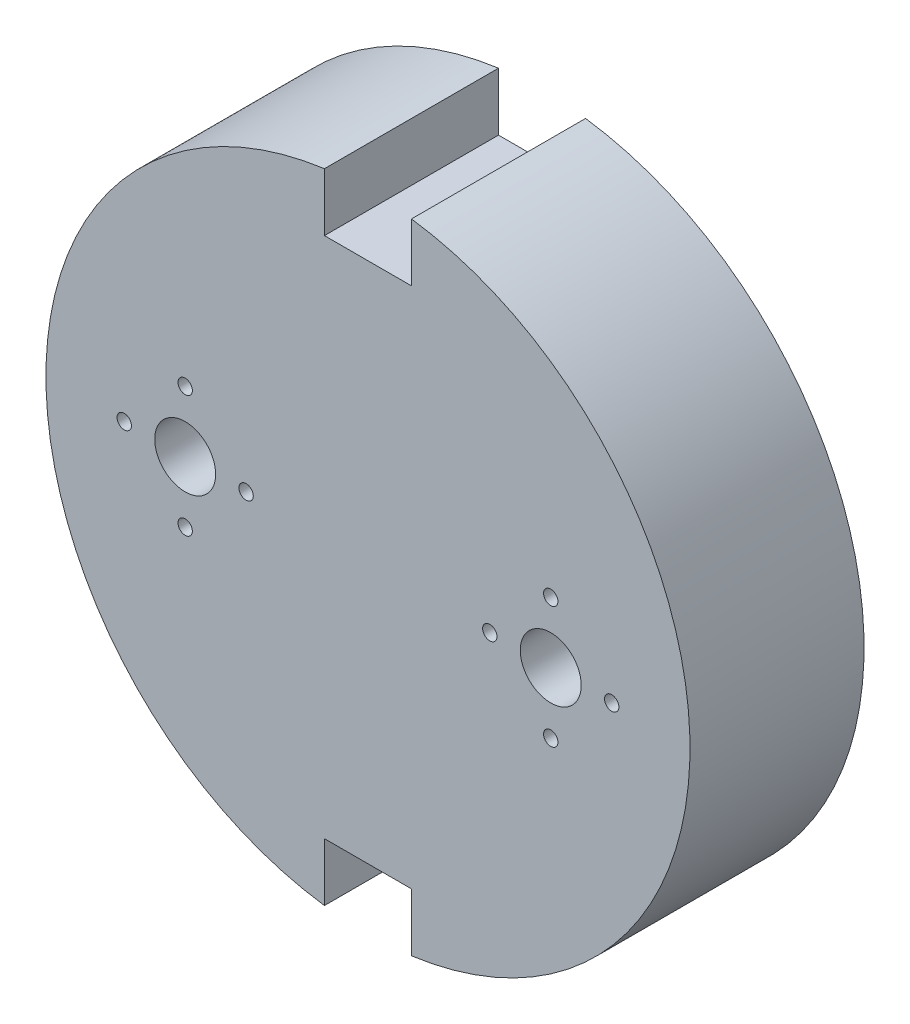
SolidWorks part; units mm, degrees
ref_plane "Plan de face" through (0, 0, 0) normal (0, 0, 1) x (1, 0, 0)
ref_plane "Plan de dessus" through (0, 0, 0) normal (0, 1, 0) x (1, 0, 0)
ref_plane "Plan de droite" through (0, 0, 0) normal (1, 0, 0) x (0, 0, -1)
sketch "Esquisse1" plane through (0, 0, 0) normal (0, 0, 1) x (1, 0, 0)
  line L2 (-10, 73.3212) -> (-10, 60)
  line L3 (-10, 60) -> (10, 60)
  line L4 (10, 73.3212) -> (10, 60)
  line L5 (-10, -60) -> (10, -60)
  line L6 (-10, -60) -> (-10, -73.3212)
  line L8 (10, -60) -> (10, -73.3212)
  arc A0 (10, -73.3212) -> (10, 73.3212) centre (0, 0) ccw
  arc A1 (-10, 73.3212) -> (-10, -73.3212) centre (0, 0) ccw
  circle A2 centre (-42, 0) radius 7
  circle A3 centre (42, 0) radius 7
  dimension "D1" = 148
  dimension "D5" = 14
  dimension "D7" = 14
  dimension "D2" = 60
  dimension "D3" = 60
  dimension "D4" = 20
  dimension "D6" = 10
  dimension "D8" = 42
  dimension "D9" = 42
extrude "Extrusion1" add sketch "Esquisse1" along normal blind 40
sketch "Esquisse2" plane through (0, 0, 0) normal (0, 0, -1) x (-1, 0, 0)
  circle A0 centre (0, 0) radius 15
  dimension "D1" = 30
extrude "Extrusion2" add sketch "Esquisse2" along normal blind 12
chamfer "Chanfrein1" distance 2 angle 45 1 edges at (-15, 0, -12)
hole_wizard "Trou taraudé M41" positions "Esquisse3D1" profile "Esquisse3" tap size "M4" standard "ISO"
sketch3d "Esquisse3D1"
  line L0 (-42, 0, 40) -> (-42, 0, 0) construction
  line L1 (42, 0, 40) -> (42, 0, 0) construction
  circle A0 centre (-42, 0, 40) radius 14 construction
  circle A1 centre (42, 0, 40) radius 14 construction
  point P2 (-42, 14, 40)
  point P4 (-42, -14, 40)
  point P6 (-28, 0, 40)
  point P8 (28, 0, 40)
  point P10 (42, 14, 40)
  point P12 (56, 0, 40)
  point P14 (42, -14, 40)
  point P20 (-56, 0, 40)
  point P28 (-42, 0, 54)
  point P36 (42, 0, 54)
  dimension "D1" = 28
  dimension "D6" = 28
  dimension "D3" = 42
  dimension "D2" = 42
  dimension "D4" = 42
  dimension "D5" = 42
sketch "Esquisse3" plane through (-42, 14, 40) normal (1, 0, 0) x (0, -1, 0)
  line L0 (0, 0) -> (0, 50.9914)
  line L1 (0, 50.9914) -> (1.65, 50)
  line L2 (1.65, 50) -> (1.65, 0)
  line L5 (1.65, 0) -> (0, 0)
  line L10 (0, 50.9914) -> (-1.65, 50) construction
  line L11 (0, -6.35) -> (0, 107.95) construction
  dimension "Diamètre du trou pour taraudage" = 3.3
  dimension "Profondeur du trou pour taraudage" = 50
  dimension "Angle de pointe" = 118
